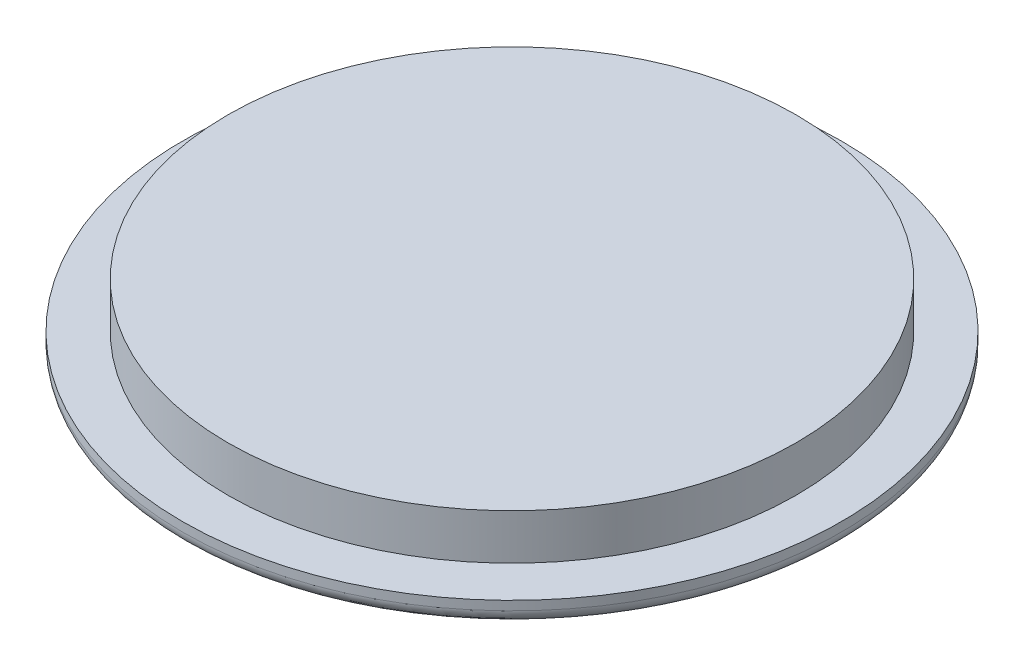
SolidWorks part; units mm, degrees
ref_plane "Plan de face" through (0, 0, 0) normal (0, 0, 1) x (1, 0, 0)
ref_plane "Plan de dessus" through (0, 0, 0) normal (0, 1, 0) x (1, 0, 0)
ref_plane "Plan de droite" through (0, 0, 0) normal (1, 0, 0) x (0, 0, -1)
ref_axis "Axe1" through (0, 55, 0) along (0, -1, 0)
sketch "Esquisse2" plane through (0, 0, 0) normal (0, 0, 1) x (1, 0, 0)
  line L0 (0, 0) -> (-72.5, 0)
  line L1 (-72.5, 0) -> (-72.5, 5)
  line L2 (-72.5, 5) -> (-62.5, 5)
  line L3 (-62.5, 15) -> (-62.5, 5)
  line L4 (-62.5, 15) -> (0, 15)
  line L6 (0, 55) -> (0, -55) construction
  line L7 (0, 0) -> (0, 15)
  dimension "D1" = 72.5
  dimension "D2" = 62.5
  dimension "D3" = 5
  dimension "D4" = 10
revolve "Révolution1" add sketch "Esquisse2" angle 360 about axis through (0, 55, 0) along (0, -1, 0)
fillet "Congé1" radius 3 1 edges at (0, 0, 72.5)
